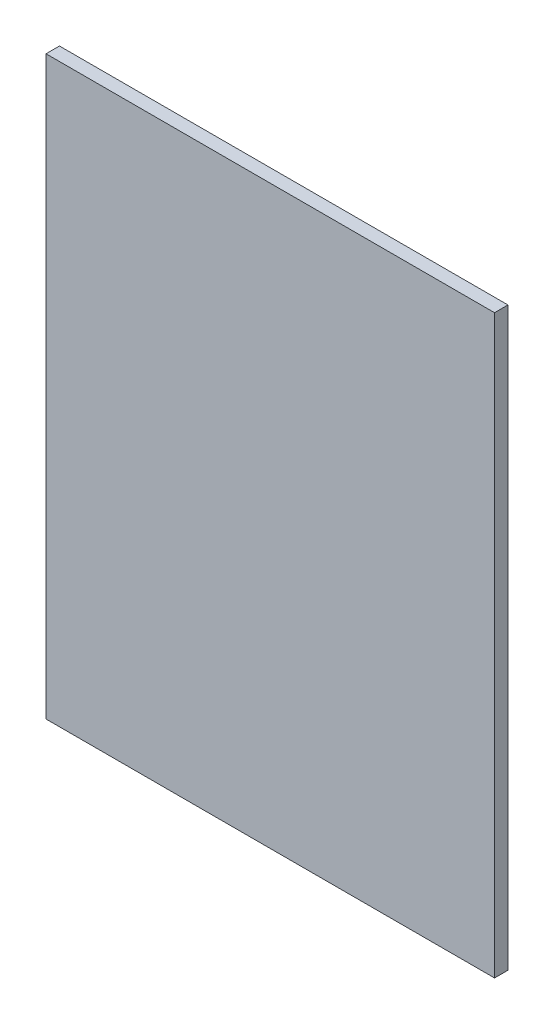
SolidWorks part; units mm, degrees
ref_plane "Front Plane" through (0, 0, 0) normal (1, 0, 0) x (0, 1, 0)
ref_plane "Top Plane" through (0, 0, 0) normal (0, 0, 1) x (0, 1, 0)
ref_plane "Right Plane" through (0, 0, 0) normal (0, 1, 0) x (-1, 0, 0)
sketch "Sketch1" plane through (0, 0, 0) normal (1, 0, 0) x (0, 1, 0)
  line L0 (0, 0) -> (68.6, 0)
  line L1 (68.6, 0) -> (68.6, 1.6)
  line L2 (68.6, 1.6) -> (0, 1.6)
  line L3 (0, 1.6) -> (0, 0)
extrude "Panel_or_block" add sketch "Sketch1" along normal blind 53.4
